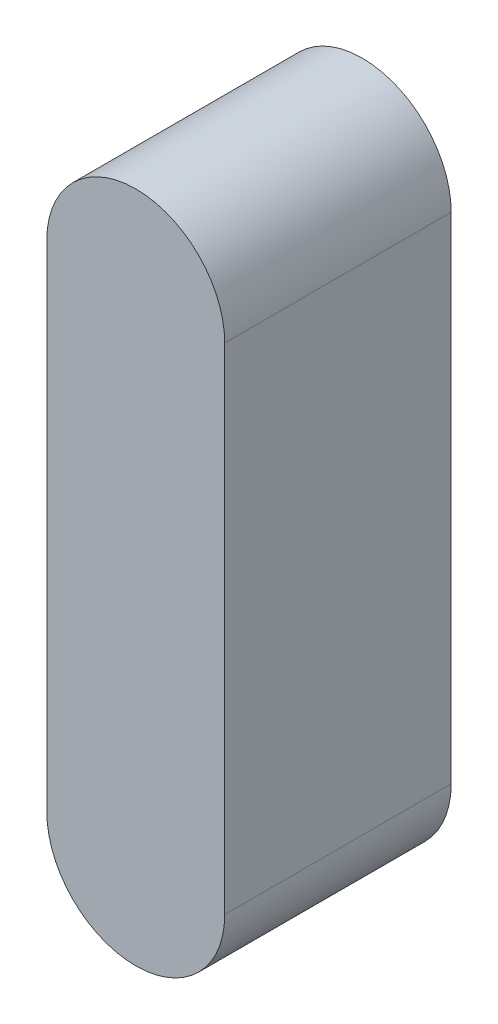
SolidWorks part; units mm, degrees
ref_plane "Front" through (0, 0, 0) normal (0, 0, 1) x (1, 0, 0)
ref_plane "Top" through (0, 0, 0) normal (0, 1, 0) x (1, 0, 0)
ref_plane "Right" through (0, 0, 0) normal (1, 0, 0) x (0, 0, -1)
sketch "Sketch1" plane through (0, 0, 0) normal (0, 0, 1) x (1, 0, 0)
  line L0 (0, 9.7155) -> (0, -9.7155) construction
  line L1 (3.4925, 9.7155) -> (3.4925, -9.7155)
  line L2 (-3.4925, 9.7155) -> (-3.4925, -9.7155)
  arc A0 (3.4925, 9.7155) -> (-3.4925, 9.7155) centre (0, 9.7155) ccw
  arc A1 (-3.4925, -9.7155) -> (3.4925, -9.7155) centre (0, -9.7155) ccw
  point P3 (0, 0)
  dimension "D1" = 3.4925
  dimension "D2" = 19.431
extrude "Boss-Extrude1" add sketch "Sketch1" along normal blind 8.89
